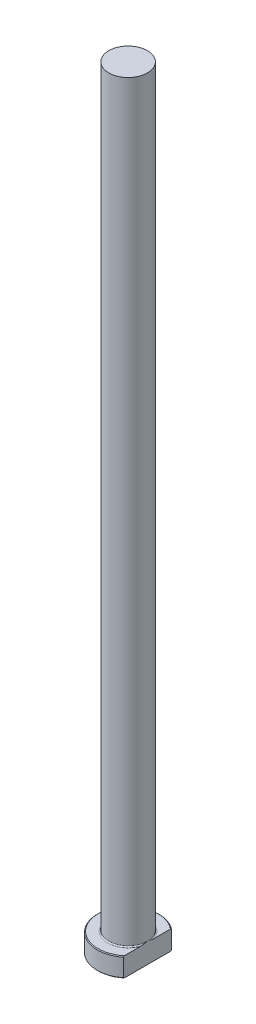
SolidWorks part; units mm, degrees
ref_plane "Front Plane" through (0, 0, 0) normal (0, 0, 1) x (1, 0, 0)
ref_plane "Top Plane" through (0, 0, 0) normal (0, 1, 0) x (1, 0, 0)
ref_plane "Right Plane" through (0, 0, 0) normal (1, 0, 0) x (0, 0, -1)
sketch "Sketch1" plane through (0, 0, 0) normal (0, 0, 1) x (1, 0, 0)
  line L0 (0, 259.9588) -> (0, -15.1925) construction
  line L1 (0, 0) -> (-8, 0)
  line L2 (-8, 0) -> (-8, 5)
  line L3 (-8, 5) -> (-5, 5)
  line L4 (-5, 5) -> (-5, 200)
  line L5 (-5, 200) -> (0, 200)
  line L6 (0, 200) -> (0, 0)
  dimension "L" = 200
  dimension "H" = 16
  dimension "T" = 5
  dimension "D" = 10
revolve "Revolve1" add sketch "Sketch1" angle 360 about L0
chamfer "Chamfer1" distance 0.2 angle 45 2 edges at (0, 5, 8) (0, 0, 8)
fillet "Fillet1" radius 0.3 1 edges at (0, 5, 5)
sketch "Sketch2" plane through (0, 0, 0) normal (0, 1, 0) x (1, 0, 0)
  line L0 (5, 6.245) -> (5, -6.245)
  circle A0 centre (0, 0) radius 8 construction
  arc A1 (5, -6.245) -> (5, 6.245) centre (0, 0) ccw
  circle A2 centre (0, 0) radius 5 construction
extrude "KEY" cut sketch "Sketch2" along normal through all
